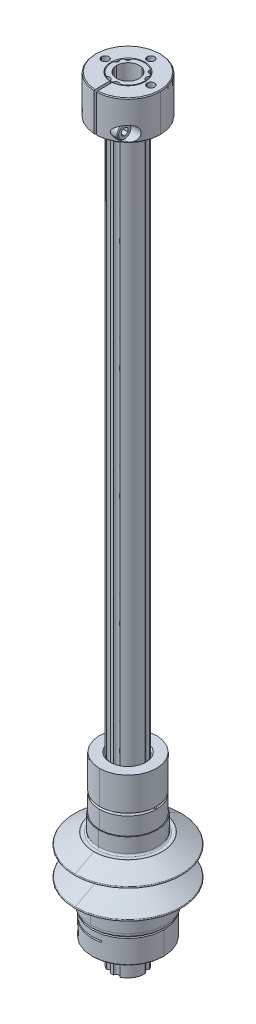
SolidWorks part; units mm, degrees
ref_plane "前视基准面" through (0, 0, 0) normal (0, 0, 1) x (1, 0, 0)
ref_plane "上视基准面" through (0, 0, 0) normal (0, 1, 0) x (1, 0, 0)
ref_plane "右视基准面" through (0, 0, 0) normal (1, 0, 0) x (0, 0, -1)
imported_body "输入1"
other "移动面2" parameters "D1"=13.8
other "移动面4" parameters "D1"=13.8
